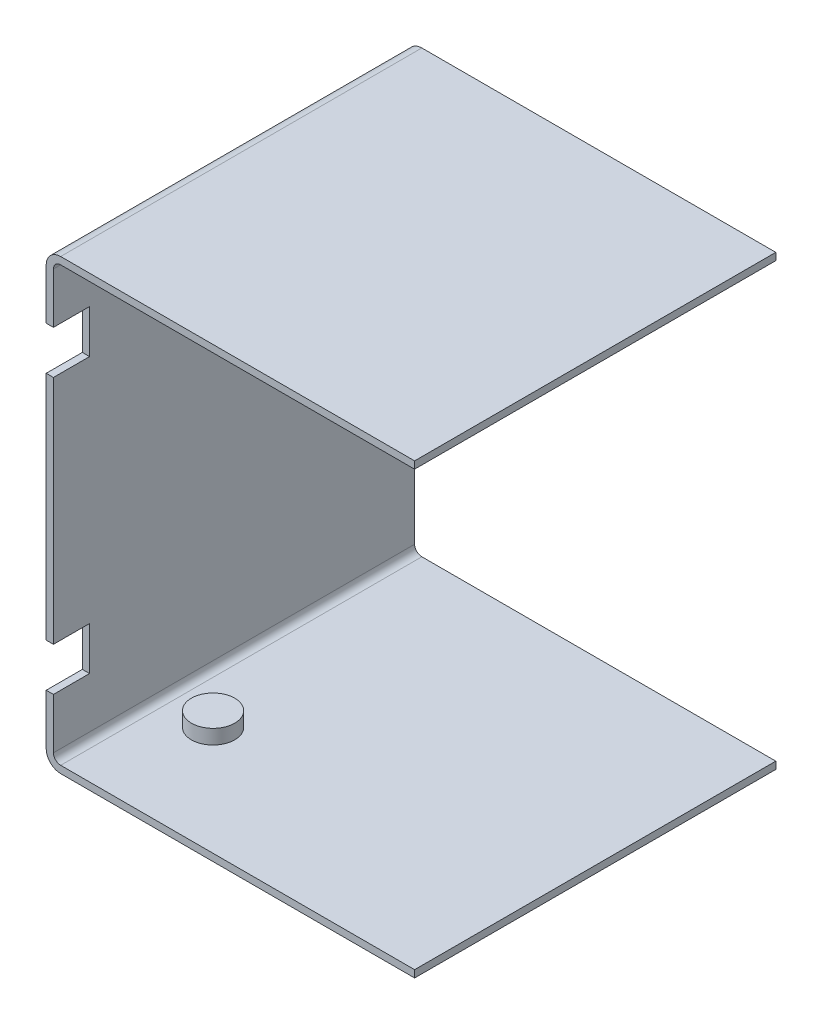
SolidWorks part; units mm, degrees
ref_plane "Face" through (0, 0, 0) normal (0, 0, 1) x (1, 0, 0)
ref_plane "Dessus" through (0, 0, 0) normal (0, 1, 0) x (1, 0, 0)
ref_plane "Droite" through (0, 0, 0) normal (1, 0, 0) x (0, 0, -1)
sketch "Esquisse1" plane through (0, 0, 0) normal (0, 0, 1) x (1, 0, 0)
  line L0 (500, 300) -> (10, 300)
  line L1 (0, 290) -> (0, 0)
  line L2 (0, 0) -> (-10, 0)
  line L3 (-10, 0) -> (-10, 290)
  line L4 (10, 310) -> (500, 310)
  line L5 (500, 310) -> (500, 300)
  arc A0 (10, 300) -> (0, 290) centre (10, 290) ccw
  arc A1 (-10, 290) -> (10, 310) centre (10, 290) cw
  point P9 (0, 300)
  point P12 (-10, 310)
  dimension "D5" = 10
  dimension "D6" = 20
  dimension "D1" = 300
  dimension "D2" = 310
  dimension "D3" = 500
  dimension "D4" = 10
extrude "Base-Extrusion" add sketch "Esquisse1" along normal blind 500
sketch "Esquisse2" plane through (0, 0, 0) normal (1, 0, 0) x (0, 0, -1)
  line L0 (-500, 0) -> (-500, 290) construction
  line L1 (-500, 220) -> (-450, 220)
  line L2 (-500, 220) -> (-500, 160)
  line L3 (-500, 160) -> (-450, 160)
  line L4 (-450, 220) -> (-450, 160)
  line L5 (-500, 310) -> (0, 310) construction
  dimension "D1" = 90
  dimension "D2" = 60
  dimension "D3" = 50
extrude "Enlèv. mat.-Extru.1" cut sketch "Esquisse2" against normal blind 1000
sketch "Esquisse4" plane through (0, 300, 0) normal (0, -1, 0) x (1, 0, 0)
  line L0 (10, 500) -> (500, 500) construction
  line L1 (500, 500) -> (500, 0) construction
  circle A0 centre (70, 349) radius 30
  dimension "D3" = 60
  dimension "D1" = 151
  dimension "D2" = 430
extrude "Boss.-Extru.2" add sketch "Esquisse4" along normal blind 20
mirror "Symétrie2" about plane through (0, 0, 0) normal (0, 1, 0)
